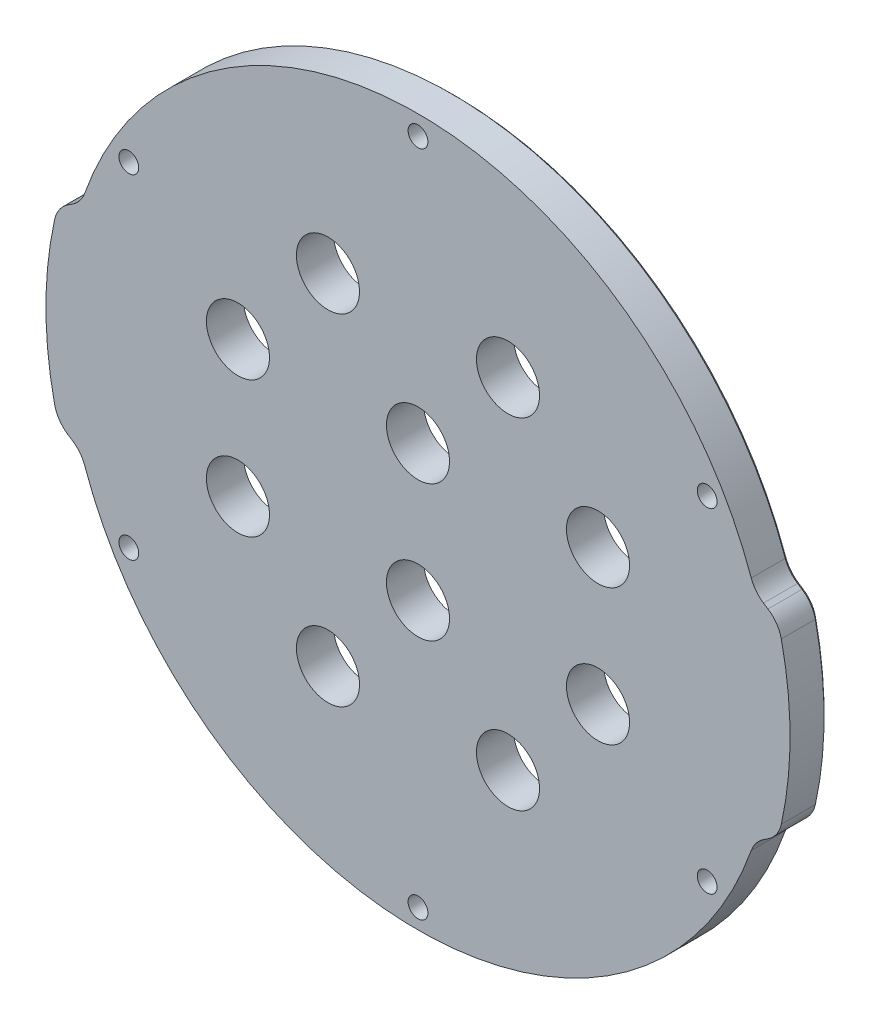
SolidWorks part; units mm, degrees
ref_plane "Front Plane" through (0, 0, 0) normal (0, 0, 1) x (1, 0, 0)
ref_plane "Top Plane" through (0, 0, 0) normal (0, 1, 0) x (1, 0, 0)
ref_plane "Right Plane" through (0, 0, 0) normal (1, 0, 0) x (0, 0, -1)
sketch "Sketch1" plane through (0, 0, 0) normal (0, 0, 1) x (1, 0, 0)
  line L0 (54.4047, 17.5) -> (58.2497, 15)
  line L1 (54.4047, -17.5) -> (58.2497, -15)
  line L2 (-54.4047, 17.5) -> (-58.2497, 15)
  line L3 (-54.4047, -17.5) -> (-58.2497, -15)
  line L4 (0, 53.975) -> (0, 0) construction
  line L5 (0, 0) -> (-46.7437, 26.9875) construction
  line L6 (-46.7437, 26.9875) -> (-49.4934, 28.575) construction
  arc A0 (54.4047, 17.5) -> (-54.4047, 17.5) centre (0, 0) ccw
  circle A1 centre (0, 53.975) radius 1.6
  circle A2 centre (46.7437, 26.9875) radius 1.6
  circle A3 centre (46.7437, -26.9875) radius 1.6
  circle A4 centre (0, -53.975) radius 1.6
  circle A5 centre (-46.7437, -26.9875) radius 1.6
  circle A6 centre (-46.7437, 26.9875) radius 1.6
  arc A7 (58.2497, -15) -> (58.2497, 15) centre (0, 0) ccw
  arc A8 (-58.2497, 15) -> (-58.2497, -15) centre (0, 0) ccw
  arc A9 (-54.4047, -17.5) -> (54.4047, -17.5) centre (0, 0) ccw
  point P17 (0, 0)
  point P26 (-60.15, 0)
  point P27 (60.15, 0)
  dimension "D1" = 114.3
  dimension "D2" = 3.175
  dimension "D3" = 3.2
  dimension "D7" = 3
  dimension "D5" = 35
  dimension "D6" = 30
  dimension "D8" = 60
  dimension "D9" = 3.175
  dimension "D4" = 6
extrude "Boss-Extrude1" add sketch "Sketch1" along normal blind 6
sketch "Sketch6" plane through (0, 0, 0) normal (0, 0, -1) x (-1, 0, 0)
  line L0 (0, 0) -> (0, 11) construction
  line L1 (0, 0) -> (0, -11) construction
  line L2 (-29.1033, 11) -> (0, 11) construction
  line L3 (0, 11) -> (29.1033, 11) construction
  line L4 (-29.1033, -11) -> (0, -11) construction
  line L5 (0, -11) -> (29.1033, -11) construction
  line L6 (-14.5516, -11) -> (-14.5516, -27.5) construction
  line L7 (14.5516, -11) -> (14.5516, -27.5) construction
  line L8 (-14.5516, 27.5) -> (-14.5516, 11) construction
  line L9 (14.5516, 27.5) -> (14.5516, 11) construction
  line L10 (-29.1033, -11) -> (0, 0) construction
  line L11 (0, 0) -> (-14.5516, -27.5) construction
  line L12 (29.1033, 11) -> (29.1033, -11) construction
  line L13 (29.1033, 11) -> (14.5516, 27.5) construction
  circle A0 centre (14.5516, 27.5) radius 5.1
  circle A1 centre (-29.1033, 11) radius 5.1
  circle A2 centre (-29.1033, -11) radius 5.1
  circle A3 centre (29.1033, -11) radius 5.1
  circle A4 centre (29.1033, 11) radius 5.1
  circle A5 centre (-14.5516, 27.5) radius 5.1
  circle A6 centre (0, -11) radius 5.1
  circle A7 centre (-14.5516, -27.5) radius 5.1
  circle A8 centre (0, 11) radius 5.1
  circle A9 centre (0, 0) radius 44.45 construction
  circle A10 centre (-14.5516, 27.5) radius 9 construction
  circle A11 centre (29.1033, 11) radius 9 construction
  circle A12 centre (29.1033, -11) radius 9 construction
  circle A13 centre (14.5516, 27.5) radius 9 construction
  circle A14 centre (-29.1033, 11) radius 9 construction
  circle A15 centre (-29.1033, -11) radius 9 construction
  circle A16 centre (0, 11) radius 9 construction
  circle A17 centre (-14.5516, -27.5) radius 9 construction
  circle A18 centre (0, -11) radius 9 construction
  circle A19 centre (14.5516, -27.5) radius 5.1
  circle A20 centre (14.5516, -27.5) radius 9 construction
  dimension "D1" = 10.2
  dimension "D2" = 88.9
  dimension "D3" = 22
  dimension "D6" = 18
extrude "Cut-Extrude2" cut sketch "Sketch6" against normal through all
fillet "Fillet1" radius 5 8 edges at (58.2497, -15, 3) (54.4047, -17.5, 3) (58.2497, 15, 3) (54.4047, 17.5, 3) (-54.4047, -17.5, 3) (-58.2497, -15, 3) (-58.2497, 15, 3) (-54.4047, 17.5, 3)
chamfer "Chamfer1" distance 0.5 angle 45 16 edges at (0, -57.15, 0) (54.6578, -17.6514, 0) (-54.6578, -17.6514, 0) (56.2186, -16.3206, 0) (-56.2186, -16.3206, 0) (57.962, -14.7428, 0) (-57.962, -14.7428, 0) (60.15, 0, 0) (-60.15, 0, 0) (57.962, 14.7428, 0) (-57.962, 14.7428, 0) (56.2186, 16.3206, 0) (-56.2186, 16.3206, 0) (54.6578, 17.6514, 0) (-54.6578, 17.6514, 0) (0, 57.15, 0)
sketch "Sketch7" plane through (0, 0, 6) normal (0, 0, 1) x (1, 0, 0)
  circle A0 centre (0, 0) radius 57.15
  circle A1 centre (0, 0) radius 44.45
  arc A2 (53.8721, 19.0768) -> (-53.8721, 19.0768) centre (0, 0) ccw construction
  dimension "D1" = 88.9
extrude "ANALYSIS-SUPPORT" [suppressed] add sketch "Sketch7" along normal blind 1
sketch "Sketch8" plane through (0, 0, 0) normal (0, 0, -1) x (-1, 0, 0)
  circle A0 centre (0, 53.975) radius 2.75
  circle A1 centre (-46.7437, 26.9875) radius 2.75
  circle A2 centre (-46.7437, -26.9875) radius 2.75
  circle A3 centre (0, -53.975) radius 2.75
  circle A4 centre (46.7437, -26.9875) radius 2.75
  circle A5 centre (46.7437, 26.9875) radius 2.75
  dimension "D1" = 5.5
extrude "ANALYSIS-SCREW-HEAD" [suppressed] add sketch "Sketch8" along normal blind 1
